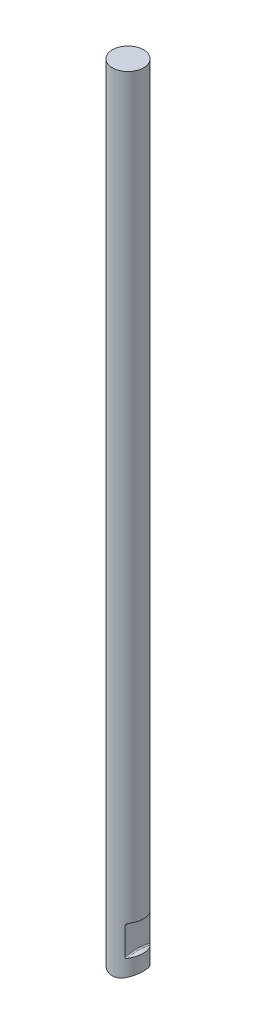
SolidWorks part; units mm, degrees
ref_plane "Front Plane" through (0, 0, 0) normal (0, 0, 1) x (1, 0, 0)
ref_plane "Top Plane" through (0, 0, 0) normal (0, 1, 0) x (1, 0, 0)
ref_plane "Right Plane" through (0, 0, 0) normal (1, 0, 0) x (0, 0, -1)
sketch "Sketch1" plane through (0, 0, 0) normal (1, 0, 0) x (0, 0, -1)
  line L0 (-5, 260) -> (-5, 0)
  line L1 (0, 249.2329) -> (0, 0) construction
  line L2 (5, 260) -> (5, 0)
  line L3 (-5, 260) -> (5, 260)
  line L6 (-5, 0) -> (5, 0)
  arc A0 (-10, 0) -> (10, 0) centre (0, 0) cw construction
  dimension "R" = 10
  dimension "L" = 250
  dimension "T" = 10
extrude "Boss-Extrude1" add sketch "Sketch1" along normal mid plane 10
sketch "Sketch8" plane through (0, 0, 0) normal (1, 0, 0) x (0, 0, -1)
  circle A0 centre (0, 0) radius 10
  arc A1 (10, 0) -> (-10, 0) centre (0, 0) ccw construction
extrude "Cut-Extrude4" cut sketch "Sketch8" against normal through all both and the other way through all
sketch "Sketch2" plane through (0, 0, 0) normal (0, 0, 1) x (1, 0, 0)
  line L0 (5, 15) -> (3, 15)
  line L1 (5, 260) -> (5, 8.6603) construction
  line L2 (3, 15) -> (3, 24.5)
  line L3 (3, 24.5) -> (5, 24.5)
  line L4 (5, 24.5) -> (5, 15)
  line L5 (0, 29.9173) -> (0, 0) construction
  line L6 (-5, 24.5) -> (-5, 15)
  line L7 (-3, 24.5) -> (-5, 24.5)
  line L8 (-3, 15) -> (-3, 24.5)
  line L9 (-5, 15) -> (-3, 15)
  line L10 (-8.8482, 0) -> (24.5305, 0) construction
  dimension "D1" = 6
  dimension "D2" = 24.5
  dimension "D3" = 15
revolve "Cut-Revolve1" cut sketch "Sketch2" angle 360 about L10
fillet "Fillet1" radius 0.762 2 edges at (-3, 24.5, 0) (3, 24.5, 0)
fillet "Fillet2" radius 0.381 2 edges at (-3, 15, 0) (3, 15, 0)
sketch "Sketch9" plane through (0, 260, 0) normal (0, 1, 0) x (1, 0, 0)
  circle A0 centre (0, 0) radius 5
  dimension "D1" = 10
extrude "Cut-Extrude5" cut sketch "Sketch9" against normal through all flip side to cut
